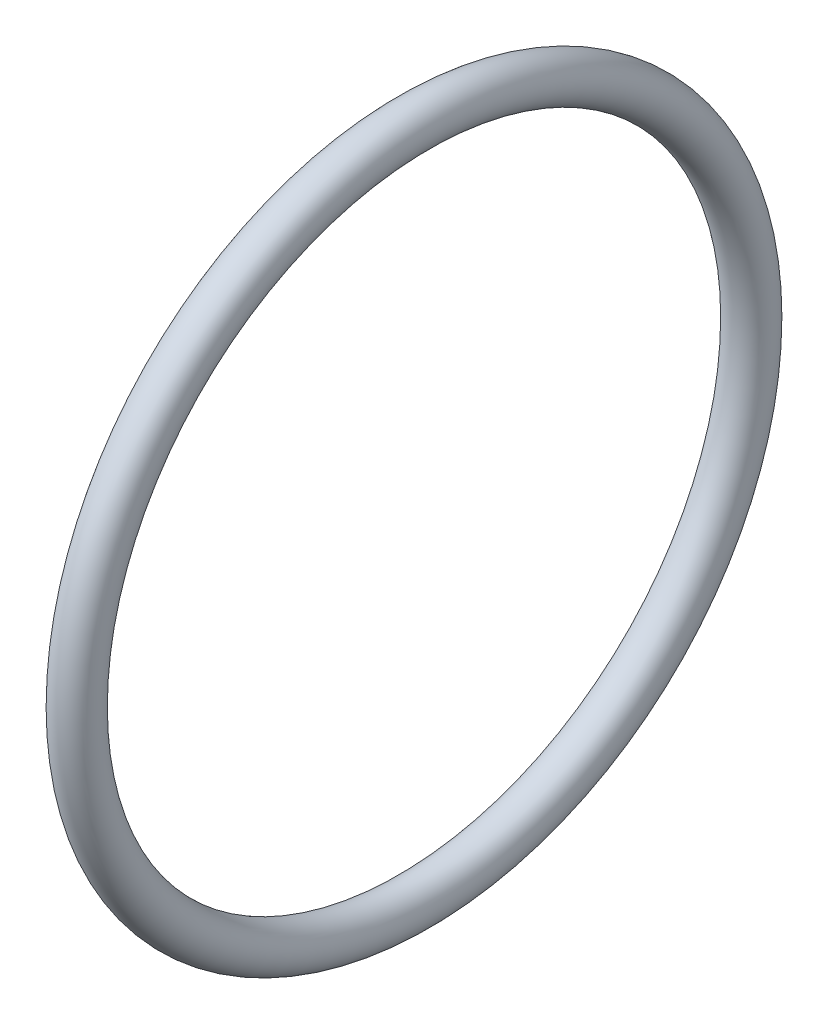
SolidWorks part; units mm, degrees
ref_plane "Front" through (0, 0, 0) normal (0, 0, 1) x (1, 0, 0)
ref_plane "Top" through (0, 0, 0) normal (0, 1, 0) x (1, 0, 0)
ref_plane "Right" through (0, 0, 0) normal (1, 0, 0) x (0, 0, -1)
sketch "Sketch1" plane through (0, 0, 0) normal (0, 0, 1) x (1, 0, 0)
  line L0 (0, 0) -> (-7.4041, 0) construction
  circle A0 centre (0, 27.4972) radius 1.7653
  dimension "D1" = 3.5306
  dimension "D2" = 27.4972
  dimension "D3" = 25.7319
revolve "Revolve1" add sketch "Sketch1" angle 360 about L0
